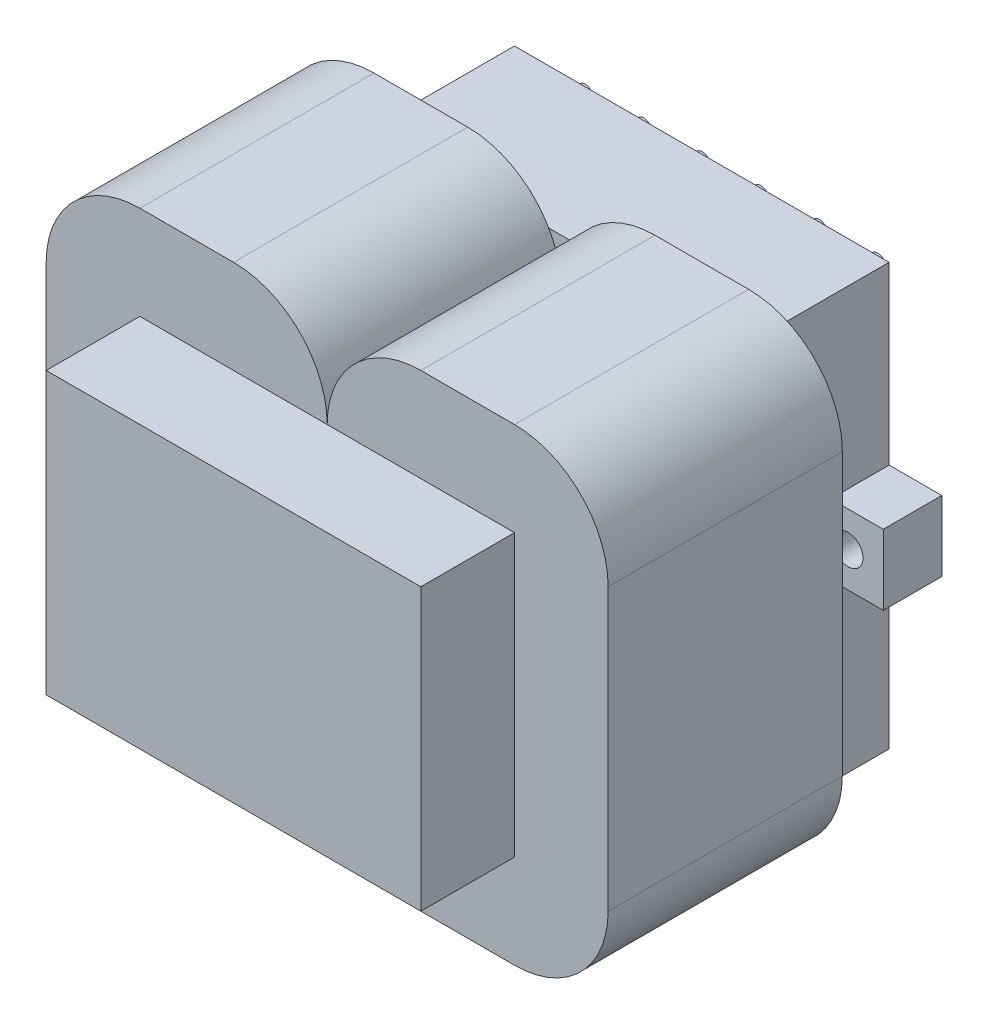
SolidWorks part; units mm, degrees
ref_plane "Front Plane" through (0, 0, 0) normal (0, 0, 1) x (1, 0, 0)
ref_plane "Top Plane" through (0, 0, 0) normal (0, 1, 0) x (1, 0, 0)
ref_plane "Right Plane" through (0, 0, 0) normal (1, 0, 0) x (0, 0, -1)
sketch "Sketch1" plane through (0, 0, 0) normal (0, 0, 1) x (1, 0, 0)
  line L1 (-16, 16) -> (16, 16)
  line L2 (-16, 16) -> (-16, -20)
  line L3 (-16, -20) -> (16, -20)
  line L4 (16, 16) -> (16, -20)
extrude "Boss-Extrude1" add sketch "Sketch1" along normal blind 12
sketch "Sketch2" plane through (16, 0, 0) normal (1, 0, 0) x (0, 0, -1)
  line L0 (0, -20) -> (0, 16) construction
  line L1 (0, 1) -> (-5, 1)
  line L2 (0, 1) -> (0, -5)
  line L3 (0, -5) -> (-5, -5)
  line L4 (-5, 1) -> (-5, -5)
extrude "Boss-Extrude2" add sketch "Sketch2" along normal blind 4.5
sketch "Sketch3" plane through (-16, 0, 0) normal (-1, 0, 0) x (0, 0, 1)
  line L0 (0, 16) -> (0, -20) construction
  line L1 (0, 1) -> (5, 1)
  line L2 (0, 1) -> (0, -5)
  line L3 (0, -5) -> (5, -5)
  line L4 (5, 1) -> (5, -5)
extrude "Boss-Extrude3" add sketch "Sketch3" along normal blind 4.5
sketch "Sketch4" plane through (0, 0, 0) normal (0, 0, -1) x (-1, 0, 0)
  circle A0 centre (-17.5006, -1.999) radius 1.27
  circle A1 centre (17.5006, -1.999) radius 1.27
extrude "Cut-Extrude1" cut sketch "Sketch4" against normal up to surface (5 mm away)
sketch "Sketch5" plane through (0, 0, 0) normal (0, 0, -1) x (-1, 0, 0)
  circle A0 centre (-10, -12.9997) radius 0.6604
  circle A1 centre (-5.0013, -12.9997) radius 0.6604
  circle A2 centre (-1.5011, -12.9997) radius 0.6604
  circle A3 centre (1.5011, -12.9997) radius 0.6604
  circle A4 centre (5.0013, -12.9997) radius 0.6604
  circle A5 centre (10, -12.9997) radius 0.6604
  circle A6 centre (-12.4993, 12.9997) radius 0.6604
  circle A7 centre (-7.5006, 12.9997) radius 0.6604
  circle A8 centre (-2.4994, 12.9997) radius 0.6604
  circle A9 centre (2.4994, 12.9997) radius 0.6604
  circle A10 centre (7.5006, 12.9997) radius 0.6604
  circle A11 centre (12.4993, 12.9997) radius 0.6604
extrude "Boss-Extrude4" add sketch "Sketch5" along normal blind 2.54 separate body
sketch "Sketch6" plane through (0, 0, 12) normal (0, 0, 1) x (1, 0, 0)
  line L1 (-16, 12) -> (16, 12)
  line L2 (-16, 12) -> (-16, -12)
  line L3 (-16, -12) -> (16, -12)
  line L4 (16, 12) -> (16, -12)
extrude "Boss-Extrude5" add sketch "Sketch6" along normal blind 28
sketch "Sketch7" plane through (0, 0, 12) normal (0, 0, 1) x (1, 0, 0)
  line L0 (-16, -20) -> (-8, -20)
  line L2 (-16, -20) -> (16, -20) construction
  line L3 (8, -20) -> (16, -20)
  line L5 (-8, 20) -> (-16, 20)
  line L6 (8, 20) -> (16, 20)
  line L7 (-24, -12) -> (-24, 12)
  line L8 (24, 12) -> (24, -12)
  line L10 (-16, -12) -> (-16, -20) construction
  line L11 (16, 12) -> (-16, 12) construction
  line L12 (16, 12) -> (-16, 12) construction
  line L13 (-16, -12) -> (16, -12) construction
  line L14 (-16, -12) -> (16, -12) construction
  arc A0 (-24, -12) -> (-16, -20) centre (-16, -12) ccw
  arc A1 (16, -20) -> (24, -12) centre (16, -12) ccw
  arc A2 (-24, 12) -> (-16, 20) centre (-16, 12) cw
  arc A3 (24, 12) -> (16, 20) centre (16, 12) ccw
  arc A4 (-8, 20) -> (0, 12) centre (-8, 12) cw
  arc A5 (0, 12) -> (8, 20) centre (8, 12) cw
  arc A6 (-8, -20) -> (0, -12) centre (-8, -12) ccw
  arc A7 (0, -12) -> (8, -20) centre (8, -12) ccw
extrude "Boss-Extrude6" add sketch "Sketch7" along normal blind 20 separate body
